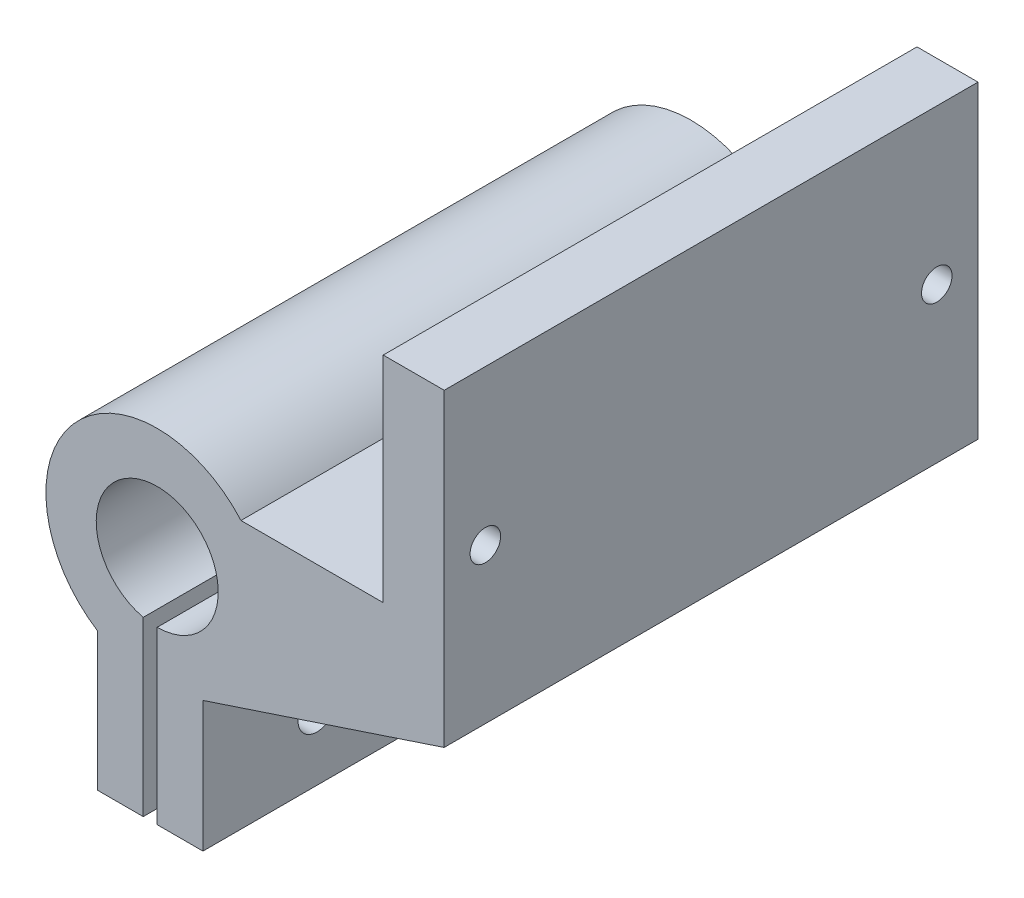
SolidWorks part; units mm, degrees
ref_plane "Front Plane" through (0, 0, 0) normal (0, 0, 1) x (1, 0, 0)
ref_plane "Top Plane" through (0, 0, 0) normal (0, 1, 0) x (1, 0, 0)
ref_plane "Right Plane" through (0, 0, 0) normal (1, 0, 0) x (0, 0, -1)
sketch "Sketch1" plane through (0, 0, 0) normal (0, 0, 1) x (1, 0, 0)
  line L0 (41.5901, 218.7703) -> (37.5901, 218.7703)
  line L1 (37.5901, 218.7703) -> (37.5901, 204.7101)
  line L2 (37.5901, 204.7101) -> (28.2611, 204.7101)
  line L3 (41.5901, 218.7703) -> (41.5851, 198.4834)
  line L4 (41.5851, 198.4834) -> (25.7704, 193.249)
  line L5 (25.7704, 193.249) -> (25.7704, 184.6898)
  line L6 (25.7704, 184.6898) -> (22.7704, 184.6898)
  line L7 (22.7704, 184.6898) -> (22.7704, 195.9022)
  line L8 (18.8539, 193.7438) -> (18.8539, 184.6898)
  line L9 (18.8539, 184.6898) -> (21.8539, 184.6898)
  line L10 (21.8539, 184.6898) -> (21.8539, 196.0086)
  arc A0 (22.7704, 195.9022) -> (21.8539, 196.0086) centre (22.7704, 199.9022) ccw
  arc A1 (28.2611, 204.7101) -> (18.8539, 193.7438) centre (22.7704, 199.9022) ccw
extrude "Boss-Extrude2" add sketch "Sketch1" along normal blind 35
sketch "Sketch2" plane through (41.5352, -0.0104, 0) normal (1, -0.0003, 0) x (0, 0, -1)
  line L0 (0, 208.6373) -> (-2.7, 208.6373) construction
  line L2 (-35, 198.4939) -> (-35, 218.7807) construction
  line L3 (-35, 208.6373) -> (-35, 198.4939) construction
  line L4 (-35, 208.6373) -> (-32.3, 208.6373) construction
  line L5 (-17.5, 208.6373) -> (-17.5, 198.4939) construction
  line L6 (-35, 198.4939) -> (0, 198.4939) construction
  circle A0 centre (-32.3, 208.6373) radius 1
  circle A1 centre (-2.7, 208.6373) radius 1
extrude "Cut-Extrude1" cut sketch "Sketch2" against normal blind 35
sketch "Sketch3" plane through (25.7704, 0, 0) normal (1, 0, 0) x (0, 0, -1)
  line L0 (-17.5, 184.6898) -> (-17.5, 193.249) construction
  line L1 (-35, 184.6898) -> (0, 184.6898) construction
  line L2 (-35, 193.249) -> (0, 193.249) construction
  circle A0 centre (-7.4825, 188.9694) radius 1.25
  circle A1 centre (-27.5175, 188.9694) radius 1.25
extrude "Cut-Extrude2" cut sketch "Sketch3" against normal blind 35
